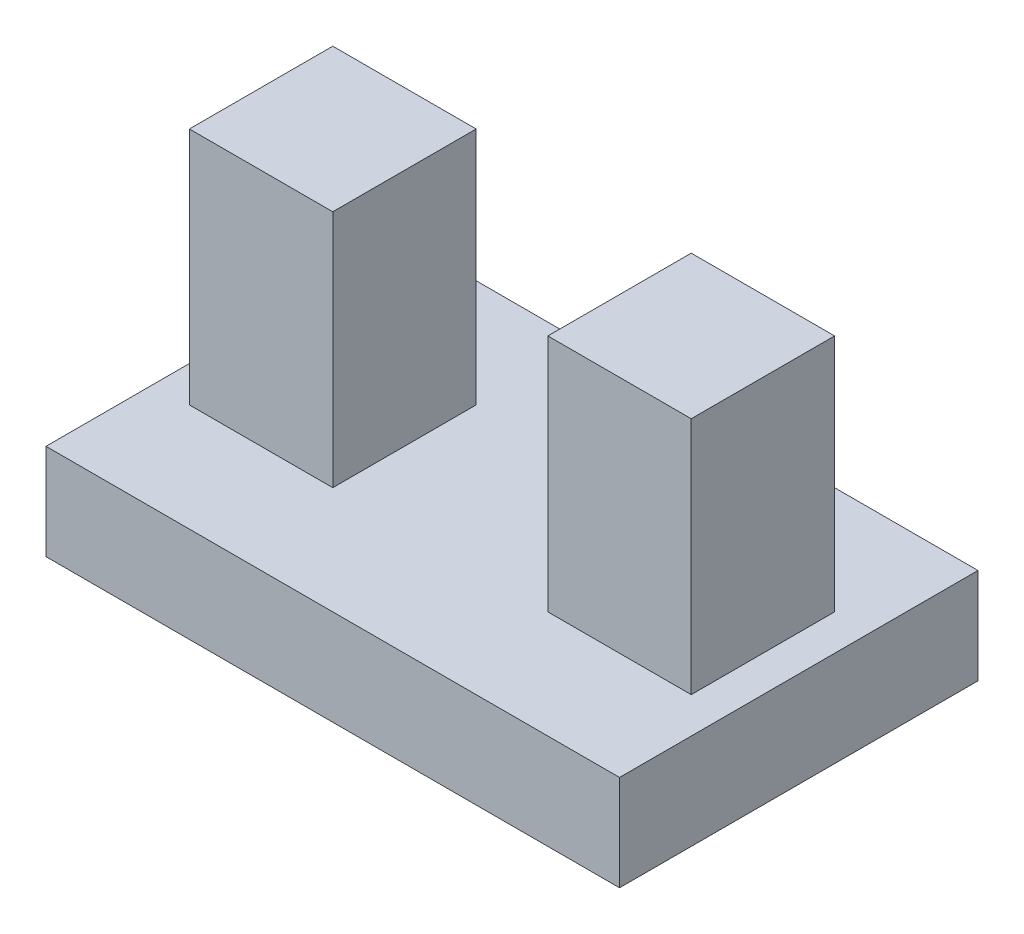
SolidWorks part; units mm, degrees
ref_plane "前视基准面" through (0, 0, 0) normal (0, 0, 1) x (1, 0, 0)
ref_plane "上视基准面" through (0, 0, 0) normal (0, 1, 0) x (1, 0, 0)
ref_plane "右视基准面" through (0, 0, 0) normal (1, 0, 0) x (0, 0, -1)
sketch "草图1" plane through (0, 0, 0) normal (0, 1, 0) x (1, 0, 0)
  line L1 (12, 7.5) -> (-12, 7.5)
  line L2 (12, 7.5) -> (12, -7.5)
  line L3 (12, -7.5) -> (-12, -7.5)
  line L4 (-12, 7.5) -> (-12, -7.5)
  line L5 (12, 7.5) -> (-12, -7.5) construction
  line L6 (12, -7.5) -> (-12, 7.5) construction
  point P0 (0, 0)
  dimension "D1" = 15
  dimension "D2" = 24
extrude "凸台-拉伸1" add sketch "草图1" along normal blind 4
sketch "草图2" plane through (0, 4, 0) normal (0, 1, 0) x (1, 0, 0)
  line L0 (-7.5, 0) -> (0, 0) construction
  line L1 (-4.5, 3) -> (-10.5, 3)
  line L2 (-4.5, 3) -> (-4.5, -3)
  line L3 (-4.5, -3) -> (-10.5, -3)
  line L4 (-10.5, 3) -> (-10.5, -3)
  line L5 (-4.5, 3) -> (-10.5, -3) construction
  line L6 (-4.5, -3) -> (-10.5, 3) construction
  line L7 (0, 0) -> (0, 7.5) construction
  line L8 (12, 7.5) -> (-12, 7.5) construction
  line L9 (4.5, -3) -> (10.5, 3) construction
  line L10 (4.5, 3) -> (10.5, -3) construction
  line L11 (10.5, 3) -> (10.5, -3)
  line L12 (4.5, -3) -> (10.5, -3)
  line L13 (4.5, 3) -> (4.5, -3)
  line L14 (4.5, 3) -> (10.5, 3)
  point P0 (-7.5, 0)
  point P15 (7.5, 0)
  dimension "D1" = 6
  dimension "D2" = 6
  dimension "D3" = 7.5
extrude "凸台-拉伸2" add sketch "草图2" along normal blind 10
